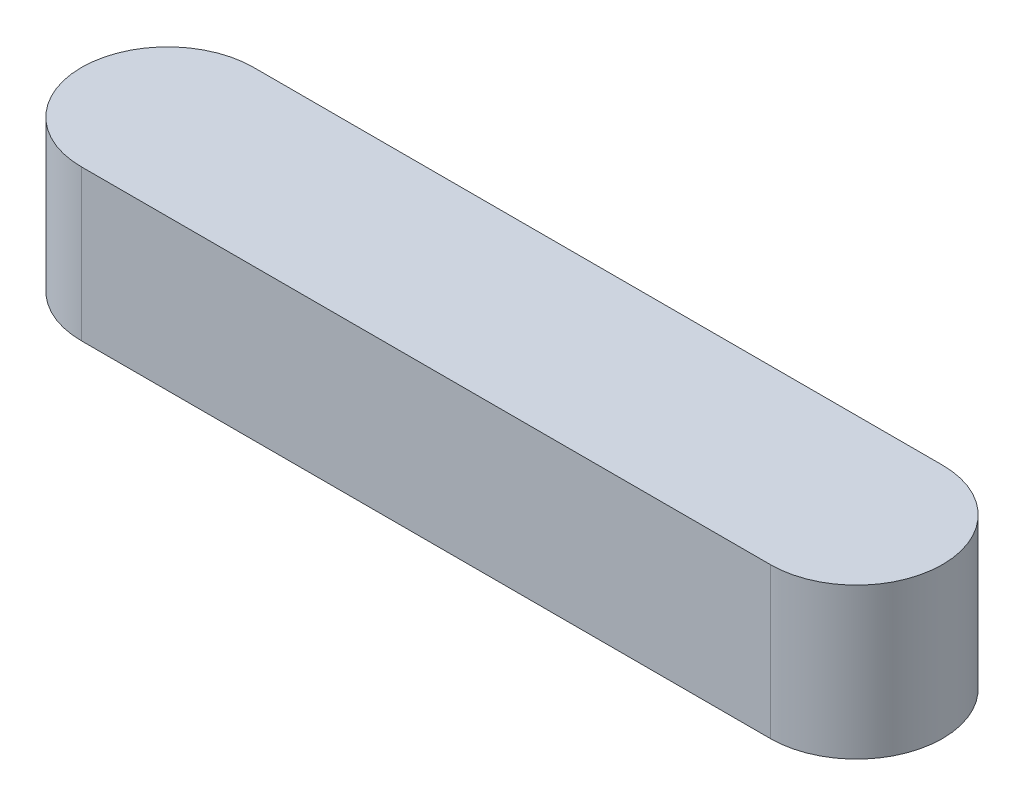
SolidWorks part; units mm, degrees
ref_plane "Спереди" through (0, 0, 0) normal (0, 0, 1) x (1, 0, 0)
ref_plane "Сверху" through (0, 0, 0) normal (0, 1, 0) x (1, 0, 0)
ref_plane "Справа" through (0, 0, 0) normal (1, 0, 0) x (0, 0, -1)
sketch "Sketch1" plane through (0, 0, 0) normal (0, 1, 0) x (1, 0, 0)
  line L0 (107.7099, 0) -> (-89.2202, 0) construction
  line L1 (32, 4) -> (0, 4)
  line L2 (0, -4) -> (32, -4)
  arc A0 (0, 4) -> (0, -4) centre (0, 0) ccw
  arc A1 (32, -4) -> (32, 4) centre (32, 0) ccw
  point P4 (-4, 0)
  point P6 (36, 0)
  dimension "D1" = 4
  dimension "D2" = 40
extrude "Extrude1" add sketch "Sketch1" along normal blind 7
